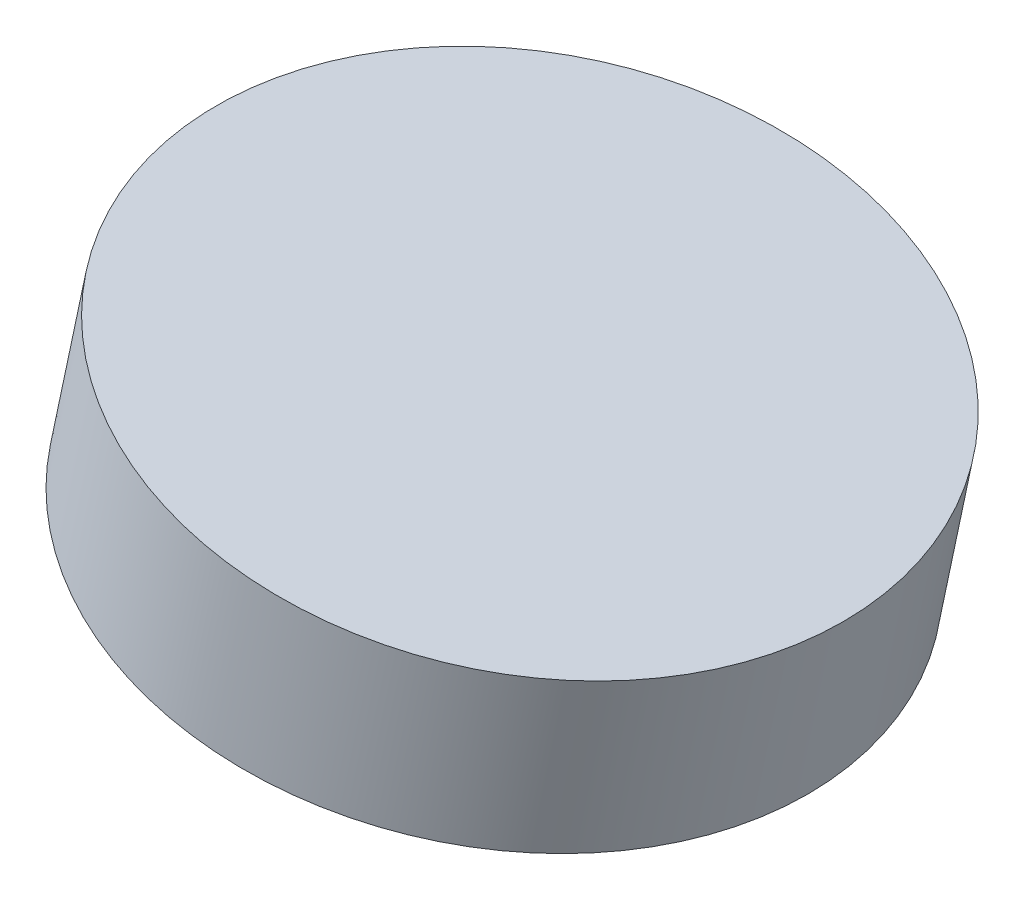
SolidWorks part; units mm, degrees
ref_plane "Face" through (0, 0, 0) normal (0, 0, 1) x (1, 0, 0)
ref_plane "Dessus" through (0, 0, 0) normal (0, 1, 0) x (1, 0, 0)
ref_plane "Droite" through (0, 0, 0) normal (1, 0, 0) x (0, 0, -1)
sketch "Esquisse1" plane through (0, 0, 0) normal (0, 0, 1) x (1, 0, 0)
  line L0 (0, 0) -> (17.1921, 80.8825) construction
  line L1 (-146.7221, 31.1868) -> (0, 0)
  line L3 (-146.7221, 31.1868) -> (-130.0892, 109.4386)
  line L4 (-130.0892, 109.4386) -> (16.6329, 78.2518)
  line L5 (16.6329, 78.2518) -> (0, 0)
  dimension "D2" = 150
  dimension "D3" = 80
revolve "Révolution1" add sketch "Esquisse1" angle 360 about L0
hole_wizard "Trou taraudé M8x1.251" positions "Esquisse3" profile "Esquisse2" tap size "M8x1.25" standard "ISO"
sketch "Esquisse3" plane through (0, 0, 0) normal (-0.2079, -0.9781, 0) x (0.9781, -0.2079, 0)
  point P0 (-130, 0)
  dimension "D1" = 130
sketch "Esquisse2" plane through (-127.1592, 27.0285, 0) normal (0, 0, 1) x (0.9781, -0.2079, 0)
  line L0 (0, 0) -> (0, 38.2929)
  line L1 (0, 38.2929) -> (3.4, 36.25)
  line L2 (3.4, 36.25) -> (3.4, 30)
  line L3 (3.4, 30) -> (4, 30)
  line L4 (4, 30) -> (4, 0)
  line L5 (4, 0) -> (0, 0)
  line L10 (0, 38.2929) -> (-3.4, 36.25) construction
  line L11 (0, -6.35) -> (0, 107.95) construction
  dimension "Diamètre du trou pour taraudage" = 6.8
  dimension "Profondeur du trou pour taraudage" = 36.25
  dimension "Diamètre principal du filetage" = 8
  dimension "Profondeur du filetage" = 30
  dimension "Angle de pointe" = 118
pattern_circular "Répétition circulaire1" count 6 every 60 about axis through (0, 0, 0) along (0.2079, 0.9781, 0)
sketch "Esquisse4" plane through (0, 0, 0) normal (-0.2079, -0.9781, 0) x (0.9781, -0.2079, 0)
  circle A0 centre (0, 0) radius 50
  dimension "D1" = 100
extrude "Enlèv. mat.-Extru.1" cut sketch "Esquisse4" against normal blind 10
chamfer "Chanfrein1" distance 1 angle 45
